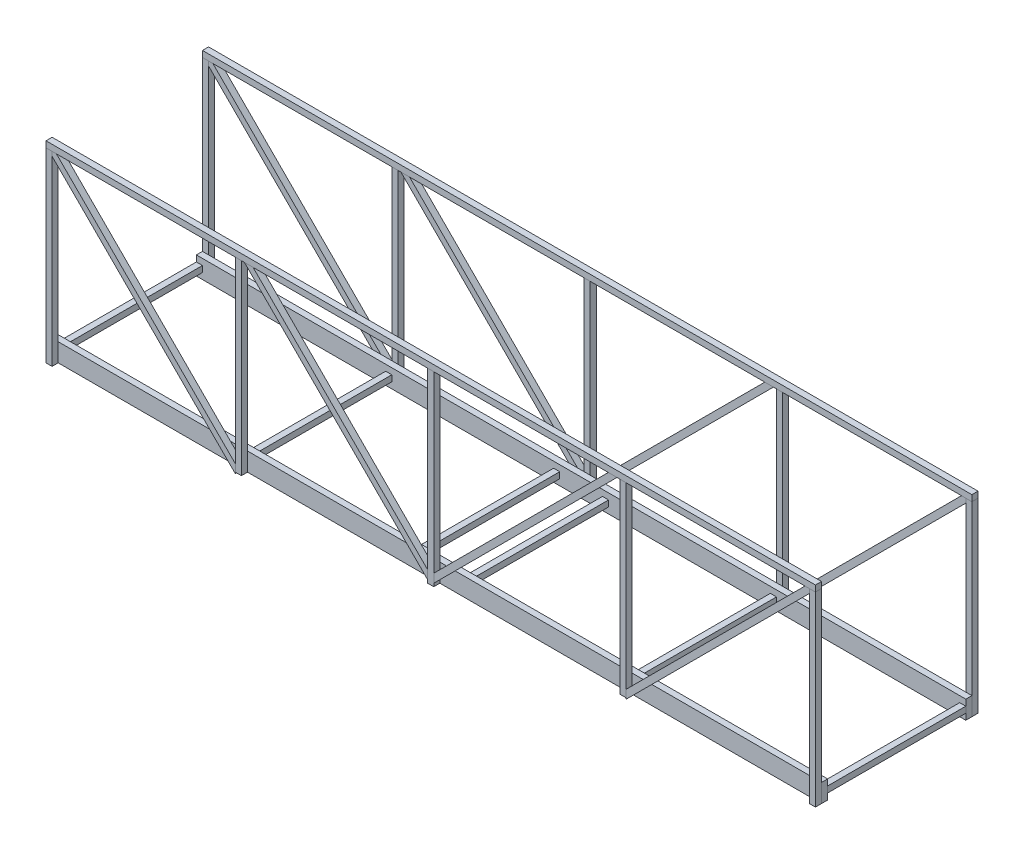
SolidWorks part; units mm, degrees
ref_plane "Front Plane" through (0, 0, 0) normal (0, 0, 1) x (1, 0, 0)
ref_plane "Top Plane" through (0, 0, 0) normal (0, 1, 0) x (1, 0, 0)
ref_plane "Right Plane" through (0, 0, 0) normal (1, 0, 0) x (0, 0, -1)
sketch "Sketch1" plane through (0, 0, 0) normal (0, 1, 0) x (1, 0, 0)
  line L0 (0, 37.5) -> (0, -37.5) construction
  line L1 (-200, -37.5) -> (200, -37.5)
  line L2 (-200, -37.5) -> (-200, 37.5)
  line L3 (-200, 37.5) -> (200, 37.5)
  line L4 (200, -37.5) -> (200, 37.5)
  line L5 (-200, -37.5) -> (200, 37.5) construction
  line L6 (-200, 37.5) -> (200, -37.5) construction
  line L7 (-100, 37.5) -> (-100, -37.5)
  line L8 (-12.7, -37.5) -> (-12.7, 37.5)
  line L9 (12.7, 37.5) -> (12.7, -37.5)
  line L10 (100, 37.5) -> (100, -37.5)
  point P0 (0, 0)
  dimension "D1" = 400
  dimension "D2" = 75
  dimension "D3" = 25.4
  dimension "D4" = 100
  dimension "D5" = 100
other "Structural Member1"
ref_plane "Plane1" through (-200, 0, 37.5) normal (1, 0, 0) x (0, 0, -1)
sketch "Sketch12" plane through (-200, 0, 37.5) normal (1, 0, 0) x (0, 0, -1)
  line L1 (-1.5875, -4.7625) -> (1.5875, -4.7625)
  line L2 (-1.5875, -4.7625) -> (-1.5875, 4.7625)
  line L3 (-1.5875, 4.7625) -> (1.5875, 4.7625)
  line L4 (1.5875, -4.7625) -> (1.5875, 4.7625)
  line L5 (-1.5875, -4.7625) -> (1.5875, 4.7625) construction
  line L6 (-1.5875, 4.7625) -> (1.5875, -4.7625) construction
  point P0 (0, 0)
  point P5 (0, 4.7625)
  point P6 (1.5875, 0)
  point P7 (0, -4.7625)
  point P8 (-1.5875, 0)
  point P9 (0, 0)
  dimension "D1" = 3.175
  dimension "D2" = 9.525
other "Structural Member2"
ref_plane "Plane2" through (200, 0, 37.5) normal (0, 0, -1) x (-1, 0, 0)
sketch "Sketch14" plane through (198.4125, 0, 37.5) normal (0, 0, -1) x (-1, 0, 0)
  line L1 (-1.5875, -1.5875) -> (1.5875, -1.5875)
  line L2 (-1.5875, -1.5875) -> (-1.5875, 1.5875)
  line L3 (-1.5875, 1.5875) -> (1.5875, 1.5875)
  line L4 (1.5875, -1.5875) -> (1.5875, 1.5875)
  line L5 (-1.5875, -1.5875) -> (1.5875, 1.5875) construction
  line L6 (-1.5875, 1.5875) -> (1.5875, -1.5875) construction
  point P0 (0, 0)
  point P5 (-1.5875, 0)
  point P6 (0, 1.5875)
  point P7 (1.5875, 0)
  point P8 (0, -1.5875)
  point P9 (0, 0)
  dimension "D1" = 3.175
other "Structural Member3"
ref_plane "Plane3" through (-200, 0, 37.5) normal (0, 0, -1) x (-1, 0, 0)
sketch "Sketch15" plane through (-198.4125, 0, 37.5) normal (0, 0, -1) x (-1, 0, 0)
  line L1 (-1.5875, -1.5875) -> (1.5875, -1.5875)
  line L2 (-1.5875, -1.5875) -> (-1.5875, 1.5875)
  line L3 (-1.5875, 1.5875) -> (1.5875, 1.5875)
  line L4 (1.5875, -1.5875) -> (1.5875, 1.5875)
  line L5 (-1.5875, -1.5875) -> (1.5875, 1.5875) construction
  line L6 (-1.5875, 1.5875) -> (1.5875, -1.5875) construction
  point P0 (0, 0)
  point P5 (-1.5875, 0)
  point P6 (0, 1.5875)
  point P7 (1.5875, 0)
  point P8 (0, -1.5875)
  point P9 (0, 0)
  dimension "D1" = 3.175
other "Structural Member4"
ref_plane "Plane4" through (-100, 0, -37.5) normal (0, 0, 1) x (1, 0, 0)
sketch "Sketch16" plane through (-100, 0, -37.5) normal (0, 0, 1) x (1, 0, 0)
  line L1 (-1.5875, -1.5875) -> (1.5875, -1.5875)
  line L2 (-1.5875, -1.5875) -> (-1.5875, 1.5875)
  line L3 (-1.5875, 1.5875) -> (1.5875, 1.5875)
  line L4 (1.5875, -1.5875) -> (1.5875, 1.5875)
  line L5 (-1.5875, -1.5875) -> (1.5875, 1.5875) construction
  line L6 (-1.5875, 1.5875) -> (1.5875, -1.5875) construction
  point P0 (0, 0)
  point P5 (-1.5875, 0)
  point P6 (0, 1.5875)
  point P7 (1.5875, 0)
  point P8 (0, -1.5875)
  point P9 (0, 0)
  dimension "D1" = 3.175
other "Trim/Extend1"
sketch "Sketch18" plane through (0, 0, 39.0875) normal (0, 0, 1) x (1, 0, 0)
  line L0 (-200, -4.7625) -> (-200, 95.2375)
  line L1 (-200, 95.2375) -> (200, 95.2375)
  line L2 (200, -4.7625) -> (200, 95.2375)
  line L3 (0, -4.7625) -> (0, 95.2375)
  line L4 (200, -4.7625) -> (-200, -4.7625) construction
  line L5 (-100, 95.2375) -> (-100, -4.7625)
  line L6 (100, 95.2375) -> (100, -4.7625)
  dimension "D1" = 100
  dimension "D2" = 100
  dimension "D3" = 100
other "Structural Member5"
ref_plane "Plane5" through (-200, -4.7625, 39.0875) normal (0, 1, 0) x (-1, 0, 0)
sketch "Sketch17" plane through (-198.4125, -4.7625, 40.675) normal (0, 1, 0) x (-1, 0, 0)
  line L1 (-1.5875, -1.5875) -> (1.5875, -1.5875)
  line L2 (-1.5875, -1.5875) -> (-1.5875, 1.5875)
  line L3 (-1.5875, 1.5875) -> (1.5875, 1.5875)
  line L4 (1.5875, -1.5875) -> (1.5875, 1.5875)
  line L5 (-1.5875, -1.5875) -> (1.5875, 1.5875) construction
  line L6 (-1.5875, 1.5875) -> (1.5875, -1.5875) construction
  point P0 (0, 0)
  point P5 (-1.5875, 0)
  point P6 (0, 1.5875)
  point P7 (1.5875, 0)
  point P8 (0, -1.5875)
  point P9 (0, 0)
  dimension "D1" = 3.175
other "Structural Member6"
ref_plane "Plane6" through (200, -4.7625, 39.0875) normal (0, 1, 0) x (-1, 0, 0)
sketch "Sketch19" plane through (198.4125, -4.7625, 40.675) normal (0, 1, 0) x (-1, 0, 0)
  line L1 (-1.5875, -1.5875) -> (1.5875, -1.5875)
  line L2 (-1.5875, -1.5875) -> (-1.5875, 1.5875)
  line L3 (-1.5875, 1.5875) -> (1.5875, 1.5875)
  line L4 (1.5875, -1.5875) -> (1.5875, 1.5875)
  line L5 (-1.5875, -1.5875) -> (1.5875, 1.5875) construction
  line L6 (-1.5875, 1.5875) -> (1.5875, -1.5875) construction
  point P0 (0, 0)
  point P5 (-1.5875, 0)
  point P6 (0, 1.5875)
  point P7 (1.5875, 0)
  point P8 (0, -1.5875)
  point P9 (0, 0)
  dimension "D1" = 3.175
other "Structural Member7"
ref_plane "Plane7" through (100, 95.2375, 39.0875) normal (0, -1, 0) x (1, 0, 0)
sketch "Sketch110" plane through (100, 95.2375, 40.675) normal (0, -1, 0) x (1, 0, 0)
  line L1 (-1.5875, -1.5875) -> (1.5875, -1.5875)
  line L2 (-1.5875, -1.5875) -> (-1.5875, 1.5875)
  line L3 (-1.5875, 1.5875) -> (1.5875, 1.5875)
  line L4 (1.5875, -1.5875) -> (1.5875, 1.5875)
  line L5 (-1.5875, -1.5875) -> (1.5875, 1.5875) construction
  line L6 (-1.5875, 1.5875) -> (1.5875, -1.5875) construction
  point P0 (0, 0)
  point P5 (-1.5875, 0)
  point P6 (0, 1.5875)
  point P7 (1.5875, 0)
  point P8 (0, -1.5875)
  point P9 (0, 0)
  dimension "D1" = 3.175
other "Structural Member8"
ref_plane "Plane8" through (-200, 95.2375, 39.0875) normal (1, 0, 0) x (0, 1, 0)
sketch "Sketch111" plane through (-200, 93.65, 40.675) normal (1, 0, 0) x (0, 1, 0)
  line L1 (-1.5875, -1.5875) -> (1.5875, -1.5875)
  line L2 (-1.5875, -1.5875) -> (-1.5875, 1.5875)
  line L3 (-1.5875, 1.5875) -> (1.5875, 1.5875)
  line L4 (1.5875, -1.5875) -> (1.5875, 1.5875)
  line L5 (-1.5875, -1.5875) -> (1.5875, 1.5875) construction
  line L6 (-1.5875, 1.5875) -> (1.5875, -1.5875) construction
  point P0 (0, 0)
  point P5 (-1.5875, 0)
  point P6 (0, 1.5875)
  point P7 (1.5875, 0)
  point P8 (0, -1.5875)
  point P9 (0, 0)
  dimension "D1" = 3.175
other "Trim/Extend2"
sketch "Sketch124" plane through (0, 0, -39.0875) normal (0, 0, -1) x (-1, 0, 0)
  line L0 (-200, -4.7625) -> (-200, 95.2375)
  line L1 (200, -4.7625) -> (200, 95.2375)
  line L2 (0, -4.7625) -> (0, 95.2375)
  line L3 (-200, -4.7625) -> (200, -4.7625) construction
  line L4 (-100, -4.7625) -> (-100, 95.2375)
  line L5 (100, -4.7625) -> (100, 95.2375)
  line L6 (200, 95.2375) -> (-200, 95.2375)
  line L7 (200, 95.2375) -> (-200, 95.2375) construction
  line L8 (-100, 95.2375) -> (-100, -4.7625) construction
  line L9 (100, 95.2375) -> (100, -4.7625) construction
other "Structural Member15"
ref_plane "Plane16" through (200, -4.7625, -39.0875) normal (0, 1, 0) x (1, 0, 0)
sketch "Sketch125" plane through (198.4125, -4.7625, -40.675) normal (0, 1, 0) x (1, 0, 0)
  line L1 (-1.5875, -1.5875) -> (1.5875, -1.5875)
  line L2 (-1.5875, -1.5875) -> (-1.5875, 1.5875)
  line L3 (-1.5875, 1.5875) -> (1.5875, 1.5875)
  line L4 (1.5875, -1.5875) -> (1.5875, 1.5875)
  line L5 (-1.5875, -1.5875) -> (1.5875, 1.5875) construction
  line L6 (-1.5875, 1.5875) -> (1.5875, -1.5875) construction
  point P0 (0, 0)
  point P5 (-1.5875, 0)
  point P6 (0, 1.5875)
  point P7 (1.5875, 0)
  point P8 (0, -1.5875)
  point P9 (0, 0)
  dimension "D1" = 3.175
other "Structural Member16"
ref_plane "Plane17" through (-200, -4.7625, -39.0875) normal (0, 1, 0) x (1, 0, 0)
sketch "Sketch126" plane through (-198.4125, -4.7625, -40.675) normal (0, 1, 0) x (1, 0, 0)
  line L1 (-1.5875, -1.5875) -> (1.5875, -1.5875)
  line L2 (-1.5875, -1.5875) -> (-1.5875, 1.5875)
  line L3 (-1.5875, 1.5875) -> (1.5875, 1.5875)
  line L4 (1.5875, -1.5875) -> (1.5875, 1.5875)
  line L5 (-1.5875, -1.5875) -> (1.5875, 1.5875) construction
  line L6 (-1.5875, 1.5875) -> (1.5875, -1.5875) construction
  point P0 (0, 0)
  point P5 (-1.5875, 0)
  point P6 (0, 1.5875)
  point P7 (1.5875, 0)
  point P8 (0, -1.5875)
  point P9 (0, 0)
  dimension "D1" = 3.175
other "Structural Member17"
ref_plane "Plane18" through (100, -4.7625, -39.0875) normal (0, 1, 0) x (1, 0, 0)
sketch "Sketch127" plane through (100, -4.7625, -40.675) normal (0, 1, 0) x (1, 0, 0)
  line L1 (-1.5875, -1.5875) -> (1.5875, -1.5875)
  line L2 (-1.5875, -1.5875) -> (-1.5875, 1.5875)
  line L3 (-1.5875, 1.5875) -> (1.5875, 1.5875)
  line L4 (1.5875, -1.5875) -> (1.5875, 1.5875)
  line L5 (-1.5875, -1.5875) -> (1.5875, 1.5875) construction
  line L6 (-1.5875, 1.5875) -> (1.5875, -1.5875) construction
  point P0 (0, 0)
  point P5 (-1.5875, 0)
  point P6 (0, 1.5875)
  point P7 (1.5875, 0)
  point P8 (0, -1.5875)
  point P9 (0, 0)
  dimension "D1" = 3.175
other "Structural Member18"
ref_plane "Plane19" through (-200, 95.2375, -39.0875) normal (1, 0, 0) x (0, -1, 0)
sketch "Sketch128" plane through (-200, 93.65, -40.675) normal (1, 0, 0) x (0, -1, 0)
  line L1 (-1.5875, -1.5875) -> (1.5875, -1.5875)
  line L2 (-1.5875, -1.5875) -> (-1.5875, 1.5875)
  line L3 (-1.5875, 1.5875) -> (1.5875, 1.5875)
  line L4 (1.5875, -1.5875) -> (1.5875, 1.5875)
  line L5 (-1.5875, -1.5875) -> (1.5875, 1.5875) construction
  line L6 (-1.5875, 1.5875) -> (1.5875, -1.5875) construction
  point P0 (0, 0)
  point P5 (-1.5875, 0)
  point P6 (0, 1.5875)
  point P7 (1.5875, 0)
  point P8 (0, -1.5875)
  point P9 (0, 0)
  dimension "D1" = 3.175
other "Trim/Extend3"
sketch "Sketch112" plane through (0, 0, 39.0875) normal (0, 0, 1) x (1, 0, 0)
  line L0 (0, -4.7625) -> (100, 95.2375)
  line L1 (200, -4.7625) -> (-200, -4.7625) construction
  line L3 (-100, 95.2375) -> (0, -4.7625)
other "Structural Member9"
ref_plane "Plane9" through (0, -4.7625, 39.0875) normal (0.7071, 0.7071, 0) x (-0.7071, 0.7071, 0)
sketch "Sketch113" plane through (-1.1225, -3.64, 40.675) normal (0.7071, 0.7071, 0) x (-0.7071, 0.7071, 0)
  line L1 (-1.5875, -1.5875) -> (1.5875, -1.5875)
  line L2 (-1.5875, -1.5875) -> (-1.5875, 1.5875)
  line L3 (-1.5875, 1.5875) -> (1.5875, 1.5875)
  line L4 (1.5875, -1.5875) -> (1.5875, 1.5875)
  line L5 (-1.5875, -1.5875) -> (1.5875, 1.5875) construction
  line L6 (-1.5875, 1.5875) -> (1.5875, -1.5875) construction
  point P0 (0, 0)
  point P5 (-1.5875, 0)
  point P6 (0, 1.5875)
  point P7 (1.5875, 0)
  point P8 (0, -1.5875)
  point P9 (0, 0)
  dimension "D1" = 3.175
other "Trim/Extend6"
sketch "Sketch129" plane through (0, 0, -39.0875) normal (0, 0, -1) x (-1, 0, 0)
  line L0 (0, -4.7625) -> (100, 95.2375)
  line L1 (0, -4.7625) -> (-100, 95.2375)
other "Structural Member19"
ref_plane "Plane20" through (0, -4.7625, -39.0875) normal (0.7071, 0.7071, 0) x (0.7071, -0.7071, 0)
sketch "Sketch130" plane through (-1.1225, -3.64, -40.675) normal (0.7071, 0.7071, 0) x (0.7071, -0.7071, 0)
  line L1 (-1.5875, -1.5875) -> (1.5875, -1.5875)
  line L2 (-1.5875, -1.5875) -> (-1.5875, 1.5875)
  line L3 (-1.5875, 1.5875) -> (1.5875, 1.5875)
  line L4 (1.5875, -1.5875) -> (1.5875, 1.5875)
  line L5 (-1.5875, -1.5875) -> (1.5875, 1.5875) construction
  line L6 (-1.5875, 1.5875) -> (1.5875, -1.5875) construction
  point P0 (0, 0)
  point P5 (-1.5875, 0)
  point P6 (0, 1.5875)
  point P7 (1.5875, 0)
  point P8 (0, -1.5875)
  point P9 (0, 0)
  dimension "D1" = 3.175
other "Trim/Extend17"
sketch "Sketch115" plane through (0, 0, 39.0875) normal (0, 0, 1) x (1, 0, 0)
  line L0 (100, -4.7625) -> (200, 95.2375)
  line L1 (-200, 95.2375) -> (-100, -4.7625)
other "Structural Member10"
ref_plane "Plane11" through (100, -4.7625, 39.0875) normal (0.7071, 0.7071, 0) x (-0.7071, 0.7071, 0)
sketch "Sketch116" plane through (100, -4.7625, 40.675) normal (0.7071, 0.7071, 0) x (-0.7071, 0.7071, 0)
  line L1 (-1.5875, -1.5875) -> (1.5875, -1.5875)
  line L2 (-1.5875, -1.5875) -> (-1.5875, 1.5875)
  line L3 (-1.5875, 1.5875) -> (1.5875, 1.5875)
  line L4 (1.5875, -1.5875) -> (1.5875, 1.5875)
  line L5 (-1.5875, -1.5875) -> (1.5875, 1.5875) construction
  line L6 (-1.5875, 1.5875) -> (1.5875, -1.5875) construction
  point P0 (0, 0)
  point P5 (-1.5875, 0)
  point P6 (0, 1.5875)
  point P7 (1.5875, 0)
  point P8 (0, -1.5875)
  point P9 (0, 0)
  dimension "D1" = 3.175
other "Trim/Extend8"
other "Structural Member11"
ref_plane "Plane12" through (-200, 95.2375, 39.0875) normal (0.7071, -0.7071, 0) x (0.7071, 0.7071, 0)
sketch "Sketch117" plane through (-200, 95.2375, 40.675) normal (0.7071, -0.7071, 0) x (0.7071, 0.7071, 0)
  line L1 (-1.5875, -1.5875) -> (1.5875, -1.5875)
  line L2 (-1.5875, -1.5875) -> (-1.5875, 1.5875)
  line L3 (-1.5875, 1.5875) -> (1.5875, 1.5875)
  line L4 (1.5875, -1.5875) -> (1.5875, 1.5875)
  line L5 (-1.5875, -1.5875) -> (1.5875, 1.5875) construction
  line L6 (-1.5875, 1.5875) -> (1.5875, -1.5875) construction
  point P0 (0, 0)
  point P5 (-1.5875, 0)
  point P6 (0, 1.5875)
  point P7 (1.5875, 0)
  point P8 (0, -1.5875)
  point P9 (0, 0)
  dimension "D1" = 3.175
other "Trim/Extend16"
other "Trim/Extend15"
sketch "Sketch132" plane through (0, 0, -39.0875) normal (0, 0, -1) x (-1, 0, 0)
  line L0 (-100, -4.7625) -> (-200, 95.2375)
  line L1 (100, -4.7625) -> (200, 95.2375)
other "Structural Member21"
ref_plane "Plane22" through (-100, -4.7625, -39.0875) normal (-0.7071, 0.7071, 0) x (0.7071, 0.7071, 0)
sketch "Sketch133" plane through (-100, -4.7625, -40.675) normal (-0.7071, 0.7071, 0) x (0.7071, 0.7071, 0)
  line L1 (-1.5875, -1.5875) -> (1.5875, -1.5875)
  line L2 (-1.5875, -1.5875) -> (-1.5875, 1.5875)
  line L3 (-1.5875, 1.5875) -> (1.5875, 1.5875)
  line L4 (1.5875, -1.5875) -> (1.5875, 1.5875)
  line L5 (-1.5875, -1.5875) -> (1.5875, 1.5875) construction
  line L6 (-1.5875, 1.5875) -> (1.5875, -1.5875) construction
  point P0 (0, 0)
  point P5 (-1.5875, 0)
  point P6 (0, 1.5875)
  point P7 (1.5875, 0)
  point P8 (0, -1.5875)
  point P9 (0, 0)
  dimension "D1" = 3.175
other "Trim/Extend13"
other "Structural Member22"
ref_plane "Plane23" through (100, -4.7625, -39.0875) normal (0.7071, 0.7071, 0) x (0.7071, -0.7071, 0)
sketch "Sketch134" plane through (100, -4.7625, -40.675) normal (0.7071, 0.7071, 0) x (0.7071, -0.7071, 0)
  line L1 (-1.5875, -1.5875) -> (1.5875, -1.5875)
  line L2 (-1.5875, -1.5875) -> (-1.5875, 1.5875)
  line L3 (-1.5875, 1.5875) -> (1.5875, 1.5875)
  line L4 (1.5875, -1.5875) -> (1.5875, 1.5875)
  line L5 (-1.5875, -1.5875) -> (1.5875, 1.5875) construction
  line L6 (-1.5875, 1.5875) -> (1.5875, -1.5875) construction
  point P0 (0, 0)
  point P5 (-1.5875, 0)
  point P6 (0, 1.5875)
  point P7 (1.5875, 0)
  point P8 (0, -1.5875)
  point P9 (0, 0)
  dimension "D1" = 3.175
other "Trim/Extend14"
equation "\"D2@Sketch12\" = \"D1@Sketch12\" * 3"
